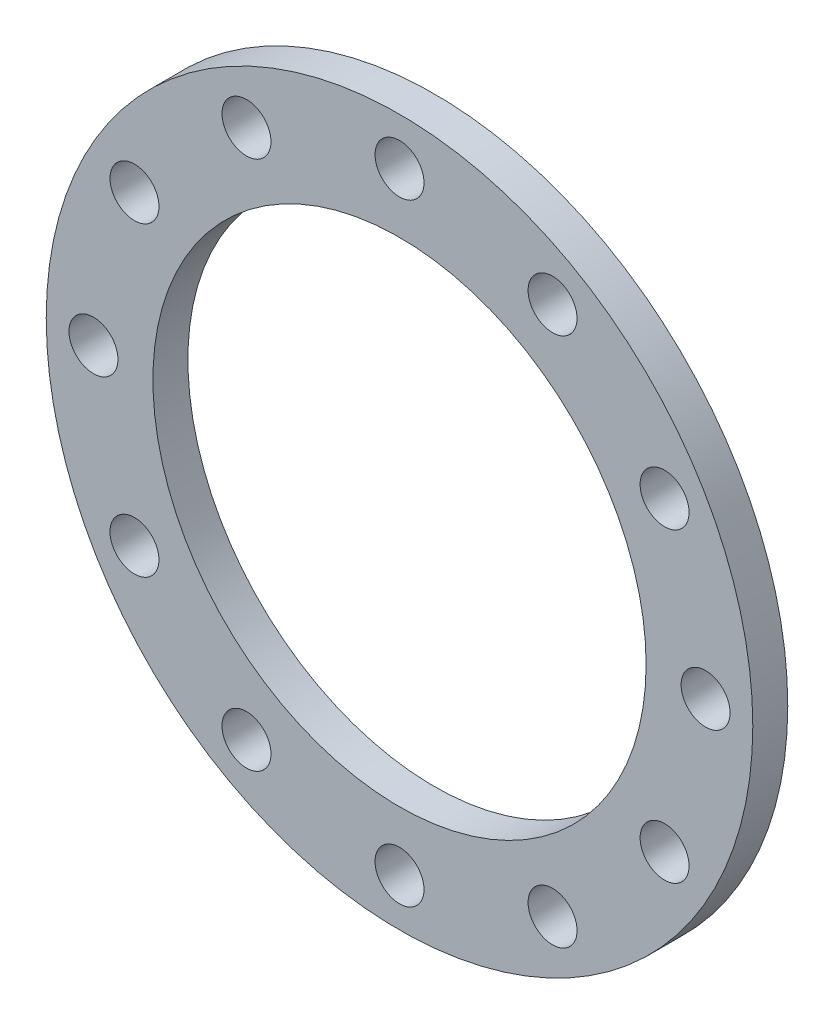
SolidWorks part; units mm, degrees
ref_plane "正面" through (0, 0, 0) normal (0, 0, 1) x (1, 0, 0)
ref_plane "平面" through (0, 0, 0) normal (0, 1, 0) x (1, 0, 0)
ref_plane "右側面" through (0, 0, 0) normal (1, 0, 0) x (0, 0, -1)
sketch "ｽｹｯﾁ1" plane through (0, 0, 0) normal (0, 0, 1) x (1, 0, 0)
  circle A0 centre (0, 0) radius 10.1
  circle A1 centre (0, 0) radius 7.05
  point P3 (0, 0)
  dimension "D1" = 20.2
  dimension "D2" = 14.1
extrude "ﾎﾞｽ - 押し出し1" add sketch "ｽｹｯﾁ1" along normal blind 1
hole_wizard "Ø1.4 (1.4) 直径の穴1" positions "ｽｹｯﾁ2" profile "ｽｹｯﾁ3" hole size "Ø1.4" standard "JIS"
sketch "ｽｹｯﾁ2" plane through (0, 0, 1) normal (0, 0, 1) x (1, 0, 0)
  line L0 (0, 0) -> (0, 8.75) construction
  point P0 (0, 8.75)
  point P8 (0, 9.4503)
  dimension "D1" = 8.75
sketch "ｽｹｯﾁ3" plane through (0, 8.75, 1) normal (1, 0, 0) x (0, -1, 0)
  line L0 (0, 0) -> (0, 1)
  line L1 (0, 1) -> (0.7, 1)
  line L2 (0.7, 1) -> (0.7, 0)
  line L5 (0.7, 0) -> (0, 0)
  line L11 (0, -6.35) -> (0, 107.95) construction
  dimension "通し穴の直径" = 1.4
  dimension "通し穴の深さ" = 1
pattern_circular "円形ﾊﾟﾀｰﾝ1" count 12 over 360 about axis through (0, 0, 0) along (0, 0, 1) of "Ø1.4 (1.4) 直径の穴1"
